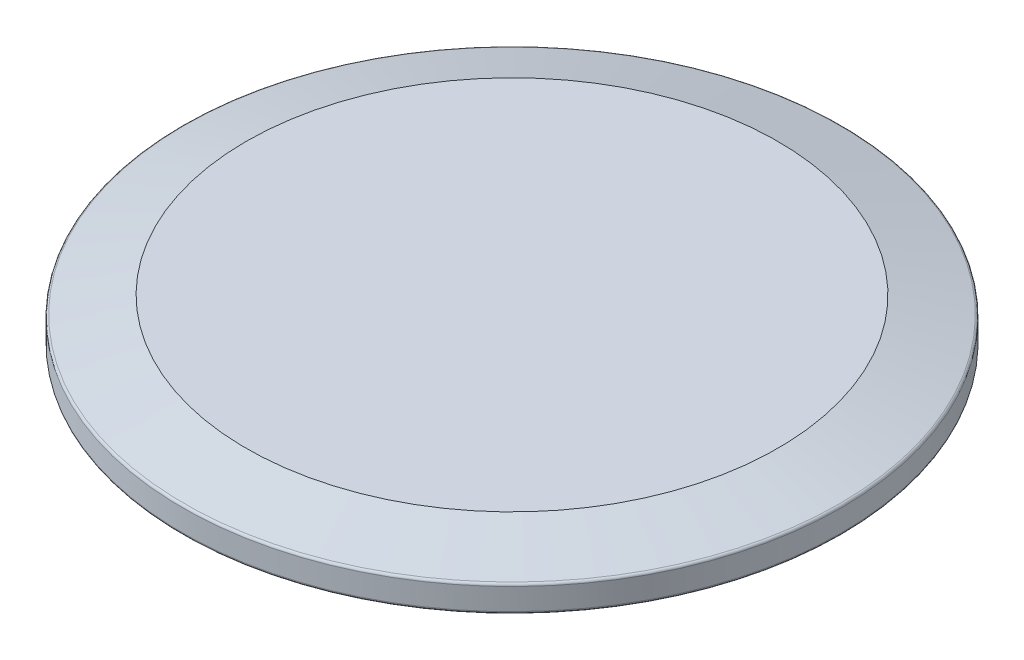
SolidWorks part; units mm, degrees
ref_plane "前视基准面" through (0, 0, 0) normal (0, 0, 1) x (1, 0, 0)
ref_plane "上视基准面" through (0, 0, 0) normal (0, 1, 0) x (1, 0, 0)
ref_plane "右视基准面" through (0, 0, 0) normal (1, 0, 0) x (0, 0, -1)
other "Configuration Table"
sketch "草图1" plane through (0, 0, 0) normal (0, 0, 1) x (1, 0, 0)
  line L0 (0, 0) -> (-23.1, 0)
  line L1 (-23.1, 0) -> (-26.3, 0)
  line L2 (-26.3, 0) -> (-37.5, 0)
  line L3 (-37.5, 0) -> (-37.5, 3)
  line L4 (-37.5, 3) -> (-30.25, 5)
  line L5 (-30.25, 5) -> (0, 5)
  line L6 (0, 5) -> (0, 0)
  line L7 (-26.3, 0) -> (-26.3, 2.5)
  line L8 (-26.3, 2.5) -> (-23.1, 2.5)
  line L9 (-23.1, 2.5) -> (-23.1, 0)
  dimension "D1" = 23.1
  dimension "D2" = 3.2
  dimension "D3" = 11.2
  dimension "D4" = 3
  dimension "D5" = 2.5
  dimension "D6" = 5
  dimension "D7" = 30.25
revolve "旋转1" add sketch "草图1" angle 360 about L6
fillet "圆角1" radius 0.3 1 edges at (-37.5, 3, 0)
fillet "圆角2" radius 0.3 1 edges at (-37.5, 0, 0)
fillet "圆角3" radius 0.3 1 edges at (-26.3, 0, 0)
